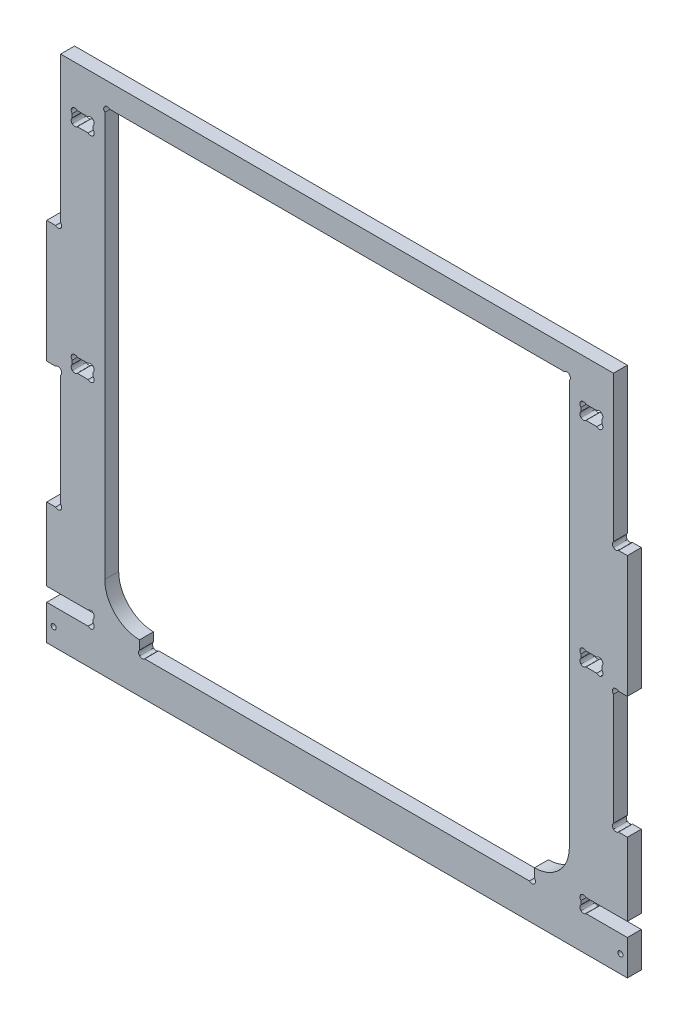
SolidWorks part; units mm, degrees
ref_plane "Plan de face" through (0, 0, 0) normal (0, 0, 1) x (1, 0, 0)
ref_plane "Plan de dessus" through (0, 0, 0) normal (0, 1, 0) x (1, 0, 0)
ref_plane "Plan de droite" through (0, 0, 0) normal (1, 0, 0) x (0, 0, -1)
body saved out of another part "Stock-Pièce3-1"
sketch "Esquisse1" plane through (0, 0, 6) normal (0, 0, 1) x (1, 0, 0)
  line L0 (2281.4907, -187.2653) -> (2286.1066, -187.2653) construction
  line L1 (2283.7987, -187.2653) -> (2305.6491, -187.2653)
  line L2 (2283.7987, -187.2653) -> (2283.7987, -193.2653)
  line L3 (2283.7987, -193.2653) -> (2305.6491, -193.2653)
  line L4 (2305.6491, -187.2653) -> (2305.6491, -193.2653)
  line L5 (2286.1066, -193.2653) -> (2281.4907, -193.2653) construction
  line L6 (2062.4907, -193.2653) -> (2067.1066, -193.2653) construction
  line L7 (2064.7987, -193.2653) -> (2034.0604, -193.2653)
  line L8 (2064.7987, -193.2653) -> (2064.7987, -187.2653)
  line L9 (2064.7987, -187.2653) -> (2034.0604, -187.2653)
  line L10 (2034.0604, -193.2653) -> (2034.0604, -187.2653)
  line L11 (2067.1066, -187.2653) -> (2062.4907, -187.2653) construction
  point P14 (2064.7987, -187.2653)
extrude "Enlèv. mat.-Extru.1" cut sketch "Esquisse1" against normal through all
sketch "Esquisse2" plane through (0, 0, 6) normal (0, 0, 1) x (1, 0, 0)
  line L0 (2067.1066, -187.2653) -> (2062.4907, -187.2653) construction
  line L1 (2064.7987, -187.2653) -> (2056.7644, -187.2653)
  line L2 (2064.7987, -187.2653) -> (2064.7987, -183.6604)
  line L3 (2064.7987, -183.6604) -> (2056.7644, -183.6604)
  line L4 (2056.7644, -187.2653) -> (2056.7644, -183.6604)
  line L5 (2062.4907, -193.2653) -> (2067.1066, -193.2653) construction
  line L6 (2064.7987, -193.2653) -> (2056.7644, -193.2653)
  line L7 (2064.7987, -193.2653) -> (2064.7987, -195.7965)
  line L8 (2064.7987, -195.7965) -> (2056.7644, -195.7965)
  line L9 (2056.7644, -193.2653) -> (2056.7644, -195.7965)
  line L10 (2281.4907, -187.2653) -> (2286.1066, -187.2653) construction
  line L11 (2283.7987, -187.2653) -> (2290.766, -187.2653)
  line L12 (2283.7987, -187.2653) -> (2283.7987, -185.4628)
  line L13 (2283.7987, -185.4628) -> (2290.766, -185.4628)
  line L14 (2290.766, -187.2653) -> (2290.766, -185.4628)
  line L15 (2288.2987, -193.2653) -> (2299.2987, -193.2653) construction
  line L16 (2291.4277, -193.2653) -> (2284.5273, -193.2653)
  line L17 (2291.4277, -193.2653) -> (2291.4277, -195.7965)
  line L18 (2291.4277, -195.7965) -> (2284.5273, -195.7965)
  line L19 (2284.5273, -193.2653) -> (2284.5273, -195.7965)
extrude "Boss.-Extru.1" add sketch "Esquisse2" against normal up to surface (6 mm away)
sketch "Esquisse3" plane through (0, 0, 6) normal (0, 0, 1) x (1, 0, 0)
  line L0 (2049.2987, -193.2653) -> (2049.2987, -208.3653) construction
  line L1 (2049.2987, -208.3653) -> (2299.2987, -208.3653) construction
  line L2 (2174.2987, -208.3653) -> (2174.2987, -250.4261) construction
  circle A0 centre (2052.2987, -200.8653) radius 1.1
  circle A1 centre (2296.2987, -200.8653) radius 1.1
  dimension "D1" = 2.2
  dimension "D2" = 3
  dimension "D3" = 7.5
extrude "Enlèv. mat.-Extru.2" cut sketch "Esquisse3" against normal through all
